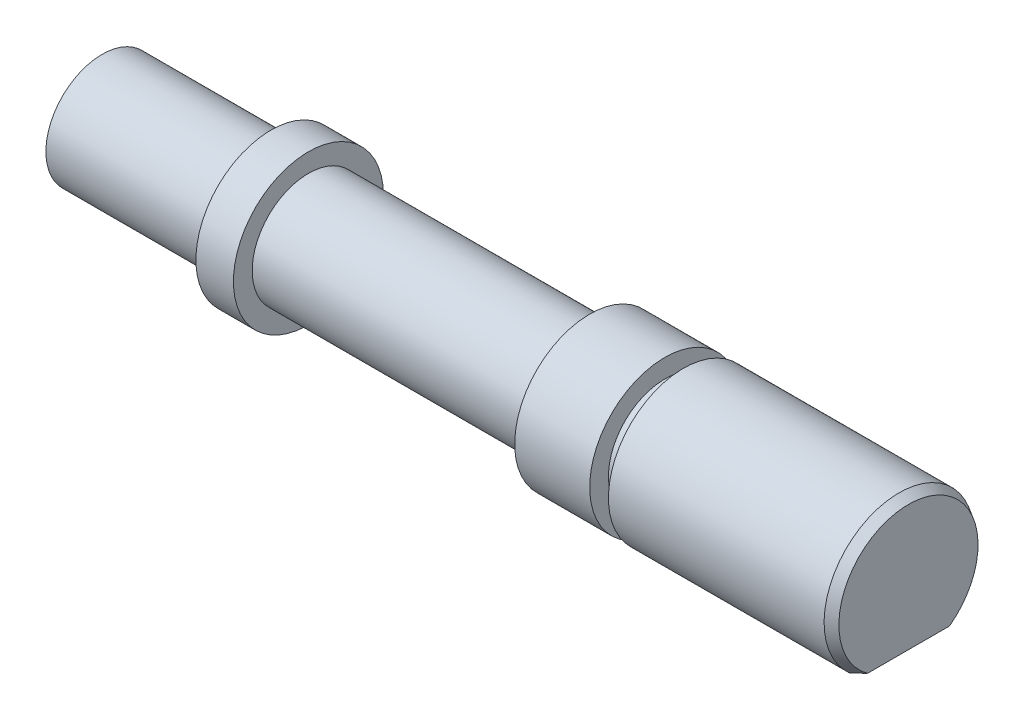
SolidWorks part; units mm, degrees
ref_plane "Plane1" through (0, 0, 0) normal (0, 0, 1) x (1, 0, 0)
ref_plane "Plane2" through (0, 0, 0) normal (0, 1, 0) x (1, 0, 0)
ref_plane "Plane3" through (0, 0, 0) normal (1, 0, 0) x (0, 0, -1)
sketch "Esquisse1" plane through (0, 0, 0) normal (0, 0, 1) x (1, 0, 0)
  line L0 (0, 0) -> (0, 3)
  line L1 (0, 3) -> (9, 3)
  line L2 (9, 3) -> (9, 4)
  line L3 (9, 4) -> (11, 4)
  line L4 (11, 4) -> (11, 3)
  line L5 (11, 3) -> (26, 3)
  line L6 (26, 3) -> (26, 4)
  line L7 (26, 4) -> (30, 4)
  line L8 (30, 4) -> (30, 3)
  line L9 (30, 3) -> (31, 3)
  line L10 (31, 3) -> (31, 4)
  line L11 (31, 4) -> (43, 4)
  line L12 (43, 4) -> (43, 0)
  line L13 (43, 0) -> (0, 0)
  line L14 (52.5, 0) -> (-2.5, 0) construction
revolve "Base-Révolution" add sketch "Esquisse1" angle 360 about L14
chamfer "Chanfrein1" distance 0.5 angle 30
ref_plane "Plan4" through (0, -3, 0) normal (0, 1, 0) x (-1, 0, 0)
sketch "Esquisse2" plane through (0, -3, 0) normal (0, 1, 0) x (-1, 0, 0)
  line L0 (-43, 3.5) -> (-33, 3.5)
  line L1 (-43, 3.5) -> (-43, -3.5)
  line L2 (-33, -3.5) -> (-43, -3.5)
  line L3 (-33, -3.5) -> (-33, 3.5)
  line L4 (-43, 3.7113) -> (-43, -3.7113) construction
extrude "Enlèv. mat.-Extru.1" cut sketch "Esquisse2" against normal blind 2
